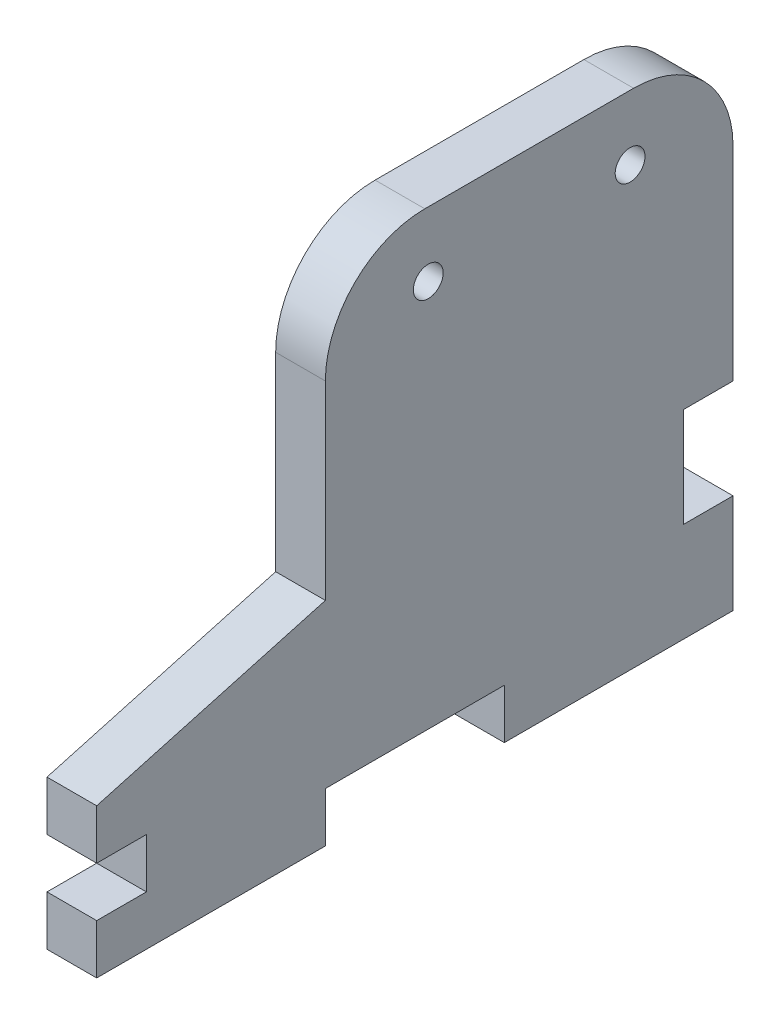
SolidWorks part; units mm, degrees
ref_plane "Plan de face" through (0, 0, 0) normal (0, 0, 1) x (1, 0, 0)
ref_plane "Plan de dessus" through (0, 0, 0) normal (0, 1, 0) x (1, 0, 0)
ref_plane "Plan de droite" through (0, 0, 0) normal (1, 0, 0) x (0, 0, -1)
sketch "Esquisse1" plane through (0, 0, 0) normal (1, 0, 0) x (0, 0, -1)
  line L2 (-19.6667, 5) -> (-19.6667, -10)
  line L3 (-19.6667, -10) -> (39.3333, -10)
  line L4 (39.3333, 20) -> (39.3333, -10)
  line L5 (-19.6667, 5) -> (39.3333, -10) construction
  line L6 (-19.6667, -10) -> (39.3333, 20) construction
  line L7 (-19.6667, 5) -> (34.3333, 20)
  line L8 (34.3333, 20) -> (39.3333, 20)
  point P0 (0, 0)
  dimension "D1" = 15
  dimension "D2" = 30
  dimension "D3" = 59
  dimension "D4" = 5
extrude "Boss.-Extru.1" add sketch "Esquisse1" along normal blind 5
sketch "Esquisse3" plane through (5, 0, 0) normal (1, 0, 0) x (0, 0, -1)
  line L0 (39.3333, 20) -> (39.3333, 10) construction
  line L1 (39.3333, 10) -> (39.3333, 0) construction
  line L2 (39.3333, 0) -> (39.3333, -10) construction
  line L9 (39.3333, -10) -> (39.3333, 20) construction
  line L11 (39.3333, 20) -> (44.3333, 20)
  line L12 (39.3333, 20) -> (39.3333, 10)
  line L13 (39.3333, 10) -> (44.3333, 10)
  line L14 (44.3333, 20) -> (44.3333, 10)
  line L15 (39.3333, 0) -> (44.3333, 0)
  line L16 (39.3333, 0) -> (39.3333, -10)
  line L17 (39.3333, -10) -> (44.3333, -10)
  line L18 (44.3333, 0) -> (44.3333, -10)
  dimension "D1" = 5
extrude "Boss.-Extru.2" add sketch "Esquisse3" against normal up to surface (5 mm away)
sketch "Esquisse4" plane through (5, 0, 0) normal (1, 0, 0) x (0, 0, -1)
  line L0 (-14.6667, -10) -> (3.3333, -10) construction
  line L1 (3.3333, -10) -> (21.3333, -10) construction
  line L2 (21.3333, -10) -> (39.3333, -10) construction
  line L3 (-19.6667, -10) -> (44.3333, -10) construction
  line L4 (44.3333, 0) -> (39.3333, 0) construction
  line L5 (3.3333, -10) -> (21.3333, -10)
  line L6 (3.3333, -10) -> (3.3333, -5)
  line L7 (3.3333, -5) -> (21.3333, -5)
  line L8 (21.3333, -10) -> (21.3333, -5)
  line L9 (-19.6667, 5) -> (-19.6667, 0) construction
  line L10 (-19.6667, 0) -> (-19.6667, -5) construction
  line L11 (-19.6667, -5) -> (-19.6667, -10) construction
  line L12 (-19.6667, 5) -> (-19.6667, -10) construction
  line L14 (-19.6667, -5) -> (-14.6667, -5)
  line L15 (-19.6667, -5) -> (-19.6667, 0)
  line L16 (-19.6667, 0) -> (-14.6667, 0)
  line L17 (-14.6667, -5) -> (-14.6667, 0)
extrude "Enlèv. mat.-Extru.1" cut sketch "Esquisse4" against normal through all both and the other way through all
sketch "Esquisse5" plane through (5, 0, 0) normal (1, 0, 0) x (0, 0, -1)
  line L0 (3.3333, 11.3889) -> (3.3333, 40.5)
  line L1 (34.3333, 20) -> (-19.6667, 5) construction
  line L2 (3.3333, 40.5) -> (44.3333, 40.5)
  line L3 (44.3333, 40.5) -> (44.3333, 20)
  line L4 (3.3333, 11.3889) -> (34.3333, 20)
  line L5 (34.3333, 20) -> (44.3333, 20)
  line L6 (-19.6667, -10) -> (3.3333, -10) construction
  line L7 (13.6833, 35.5) -> (13.6833, 40.5) construction
  line L8 (13.6833, 34) -> (3.3333, 34) construction
  line L9 (33.9833, 34) -> (44.3333, 34) construction
  circle A0 centre (13.6833, 34) radius 1.5
  circle A1 centre (33.9833, 34) radius 1.5
  dimension "D2" = 3
  dimension "D1" = 44
  dimension "D3" = 5
  dimension "D4" = 20.3
extrude "Boss.-Extru.3" add sketch "Esquisse5" against normal up to surface (5 mm away)
fillet "Congé1" radius 10 2 edges at (2.5, 40.5, -44.3333) (2.5, 40.5, -3.3333)
